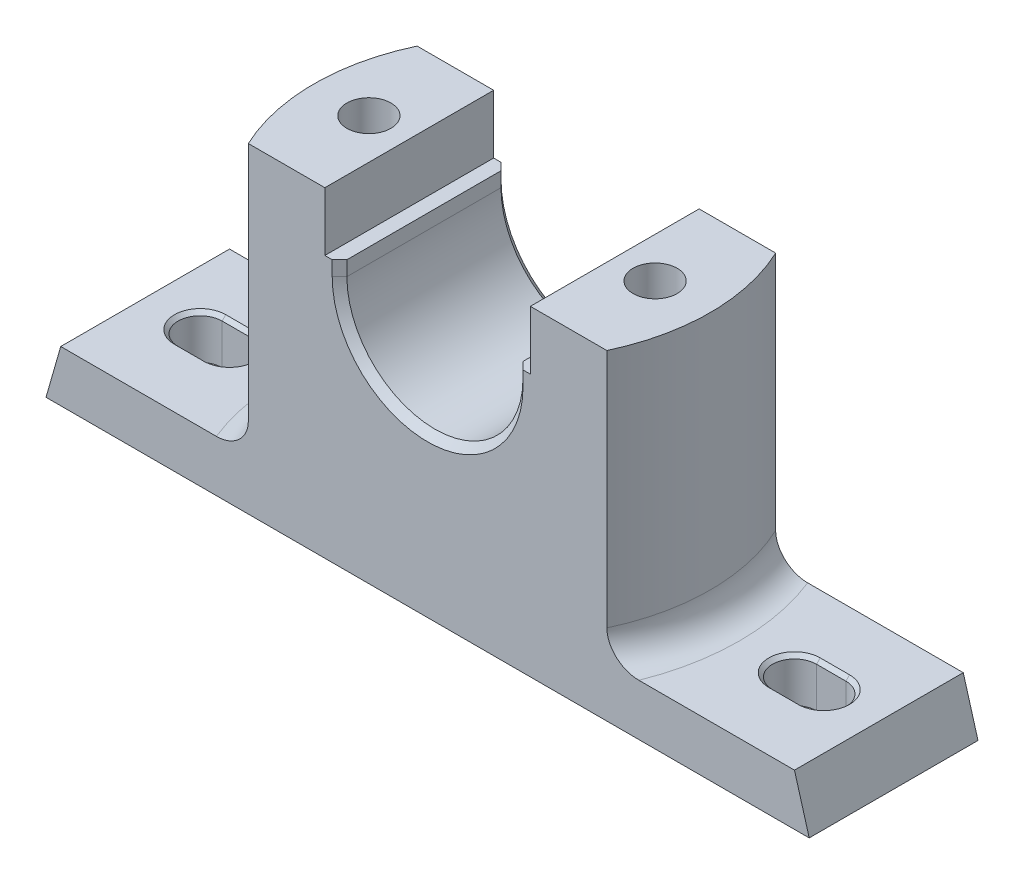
SolidWorks part; units mm, degrees
ref_plane "Front Plane" through (0, 0, 0) normal (0, 0, 1) x (1, 0, 0)
ref_plane "Top Plane" through (0, 0, 0) normal (0, 1, 0) x (1, 0, 0)
ref_plane "Right Plane" through (0, 0, 0) normal (1, 0, 0) x (0, 0, -1)
sketch "Sketch1" plane through (0, 0, 0) normal (0, 0, 1) x (1, 0, 0)
  line L0 (233.4736, 230.4857) -> (233.4736, -25.9765) construction
  line L1 (337.4736, 56.4117) -> (129.4736, 56.4117)
  line L2 (129.4736, 56.4117) -> (133.4881, 70.4117)
  line L3 (337.4736, 56.4117) -> (333.4592, 70.4117)
  line L4 (133.4881, 70.4117) -> (179.4736, 70.4117)
  line L5 (333.4592, 70.4117) -> (287.4736, 70.4117)
  line L6 (179.4736, 70.4117) -> (179.4736, 143.8822)
  line L7 (287.4736, 70.4117) -> (287.4736, 143.8822)
  line L8 (179.4736, 143.8822) -> (205.4736, 143.8822)
  line L9 (287.4736, 143.8822) -> (261.4736, 143.8822)
  line L10 (205.4736, 143.8822) -> (205.4736, 127.8822)
  line L11 (261.4736, 143.8822) -> (261.4736, 127.8822)
  line L12 (205.4736, 127.8822) -> (209.4736, 127.8822)
  line L13 (261.4736, 127.8822) -> (257.4736, 127.8822)
  line L14 (209.4736, 127.8822) -> (209.4736, 123.8822)
  line L15 (257.4736, 127.8822) -> (257.4736, 123.8822)
  arc A0 (209.4736, 123.8822) -> (257.4736, 123.8822) centre (233.4736, 123.8822) ccw
  point P5 (233.4736, 56.4117)
  dimension "D5" = 24
  dimension "D1" = 74
  dimension "D2" = 208
  dimension "D3" = 14
  dimension "D4" = 16
  dimension "D6" = 4
  dimension "D7" = 4
  dimension "D8" = 54
extrude "Boss-Extrude1" add sketch "Sketch1" along normal mid plane 46
sketch "Sketch3" plane through (0, 143.8822, 0) normal (0, 1, 0) x (1, 0, 0)
  line L4 (184.6167, 23) -> (282.3306, 23)
  line L5 (184.6167, -23) -> (282.3306, -23)
  arc A0 (184.6167, 23) -> (184.6167, -23) centre (233.4736, 0) ccw
  arc A1 (282.3306, -23) -> (282.3306, 23) centre (233.4736, 0) ccw
extrude "Cut-Extrude7" cut sketch "Sketch3" against normal up to surface (73.4704 mm away) flip side to cut
sketch "Sketch5" plane through (0, 56.4117, 0) normal (0, -1, 0) x (1, 0, 0)
  line L9 (135.9736, 17.5) -> (330.9736, 17.5)
  line L10 (135.9736, 17.5) -> (135.9736, -17.5)
  line L11 (135.9736, -17.5) -> (330.9736, -17.5)
  line L20 (330.9736, 17.5) -> (330.9736, -17.5)
  dimension "D2" = 195
  dimension "D3" = 35
extrude "Cut-Extrude9" cut sketch "Sketch5" against normal blind 2
sketch "Sketch6" plane through (0, 58.4117, 0) normal (0, -1, 0) x (1, 0, 0)
  line L0 (129.4736, 23) -> (129.4736, -23) construction
  line L1 (129.4736, 23) -> (129.4736, -23)
  line L2 (129.4736, 23) -> (337.4736, 23) construction
  line L3 (337.4736, 23) -> (337.4736, -23) construction
  line L4 (129.4736, -23) -> (337.4736, -23) construction
  line L5 (129.4736, 23) -> (337.4736, 23)
  line L6 (337.4736, 23) -> (337.4736, -23)
  line L7 (129.4736, -23) -> (337.4736, -23)
  line L8 (120.9183, 0) -> (352.7651, 0) construction
  line L9 (233.4736, 50.707) -> (233.4736, -46.3841) construction
  line L10 (194.4736, 14) -> (180.4736, 14)
  line L13 (180.4736, 14) -> (180.4736, -14)
  line L14 (180.4736, -14) -> (208.4736, -14)
  line L15 (208.4736, -14) -> (208.4736, 14)
  line L17 (194.4736, 14) -> (208.4736, 14)
  line L19 (272.4736, 14) -> (286.4736, 14)
  line L20 (286.4736, 14) -> (286.4736, -14)
  line L21 (286.4736, -14) -> (258.4736, -14)
  line L22 (258.4736, -14) -> (258.4736, 14)
  line L23 (258.4736, 14) -> (272.4736, 14)
  dimension "D4" = 14
  dimension "D6" = 28
  dimension "D7" = 28
extrude "Cut-Extrude10" cut sketch "Sketch6" against normal blind 10
sketch "Sketch13" plane through (0, 70.4117, 0) normal (0, 1, 0) x (1, 0, 0)
  line L0 (184.6167, 23) -> (133.4881, 23) construction
  line L1 (133.4881, -23) -> (133.4881, 23) construction
  line L2 (184.6167, -23) -> (133.4881, -23) construction
  line L3 (333.4592, 23) -> (282.3306, 23)
  line L4 (282.3306, -23) -> (333.4592, -23)
  line L5 (333.4592, -23) -> (333.4592, 23)
  line L6 (333.4592, 23) -> (282.3306, 23)
  line L7 (282.3306, -23) -> (333.4592, -23)
  line L8 (333.4592, -23) -> (333.4592, 23)
  line L9 (184.6167, 23) -> (133.4881, 23)
  line L10 (133.4881, -23) -> (133.4881, 23)
  line L11 (184.6167, -23) -> (133.4881, -23)
  line L12 (356.4636, 0) -> (124.7867, 0) construction
  line L13 (233.4736, 48.8122) -> (233.4736, -53.2437) construction
  line L14 (318.4736, -6) -> (310.4736, -6)
  line L15 (318.4736, 6) -> (310.4736, 6)
  line L19 (148.4736, 6) -> (156.4736, 6)
  line L20 (148.4736, -6) -> (156.4736, -6)
  arc A0 (318.4736, 6) -> (318.4736, -6) centre (318.4736, 0) cw
  arc A1 (282.3306, -23) -> (282.3306, 23) centre (233.4736, 0) ccw
  arc A2 (282.3306, -23) -> (282.3306, 23) centre (233.4736, 0) ccw
  arc A3 (310.4736, -6) -> (310.4736, 6) centre (310.4736, 0) cw
  arc A4 (148.4736, 6) -> (148.4736, -6) centre (148.4736, 0) ccw
  arc A5 (156.4736, -6) -> (156.4736, 6) centre (156.4736, 0) ccw
  dimension "D6" = 12
  dimension "D2" = 154
  dimension "D5" = 8
  dimension "D1" = 0
extrude "Cut-Extrude11" cut sketch "Sketch13" against normal through all contours L20 A5 L19 A4 | A3 L14 A0 L15
other "Hole2"
sketch "Sketch15" plane through (0, 143.8822, 0) normal (0, 1, 0) x (1, 0, 0)
  line L0 (257.4736, 23) -> (209.4736, 23) construction
  line L1 (205.4736, 23) -> (184.6167, 23) construction
  circle A0 centre (194.4736, 0) radius 6
  point P2 (233.4736, 23)
  dimension "D1" = 12
  dimension "D2" = 39
  dimension "D3" = 23
other "Hole3"
sketch "Sketch16" plane through (0, 143.8822, 0) normal (0, 1, 0) x (1, 0, 0)
  line L0 (129.4736, 23) -> (337.4736, 23) construction
  line L1 (209.4736, -23) -> (257.4736, -23) construction
  circle A0 centre (272.4736, 0) radius 6
  point P2 (233.4736, 23)
  dimension "D1" = 12
  dimension "D2" = 39
  dimension "D3" = 23
fillet "Fillet1" radius 8 2 edges at (179.4736, 70.4117, 0) (287.4736, 70.4117, 0)
chamfer "Chamfer1" distance 1 angle 45 8 edges at (304.4736, 70.4117, 0) (314.4736, 70.4117, -6) (314.4736, 70.4117, 6) (324.4736, 70.4117, 0) (142.4736, 70.4117, 0) (152.4736, 70.4117, 6) (152.4736, 70.4117, -6) (162.4736, 70.4117, 0)
chamfer "Chamfer2" distance 2 angle 45 6 edges at (257.4736, 125.8822, -23) (209.4736, 125.8822, -23) (233.4736, 99.8822, -23) (257.4736, 125.8822, 23) (209.4736, 125.8822, 23) (233.4736, 99.8822, 23)
